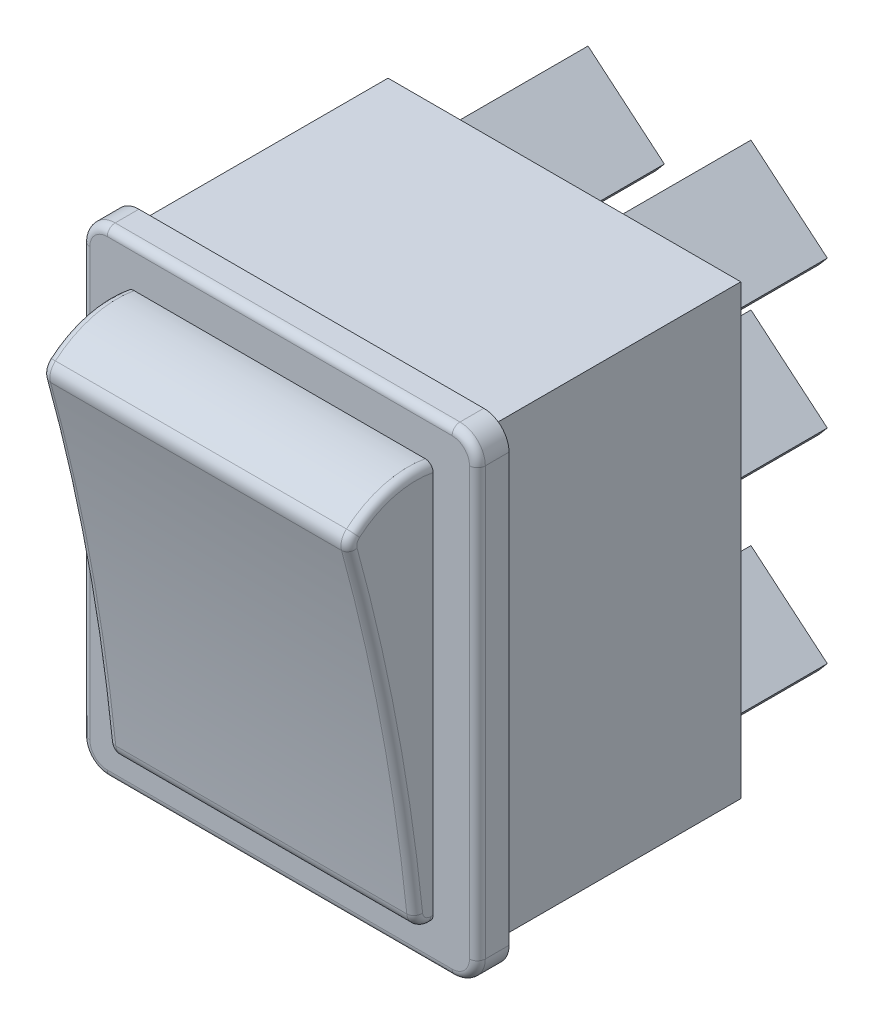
SolidWorks part; units mm, degrees
ref_plane "Front" through (0, 0, 0) normal (0, 0, 1) x (1, 0, 0)
ref_plane "Top" through (0, 0, 0) normal (0, 1, 0) x (1, 0, 0)
ref_plane "Right" through (0, 0, 0) normal (1, 0, 0) x (0, 0, -1)
sketch "Sketch1" plane through (0, 0, 0) normal (0, 0, 1) x (1, 0, 0)
  line L1 (0, 0) -> (25, 0)
  line L2 (0, 0) -> (0, 30.2)
  line L3 (0, 30.2) -> (25, 30.2)
  line L4 (25, 0) -> (25, 30.2)
  dimension "D1" = 25
  dimension "D2" = 30.2
extrude "Extrude1" add sketch "Sketch1" along normal blind 2
fillet "Fillet1" radius 1.6 4 edges at (0, 30.2, 1) (0, 0, 1) (25, 0, 1) (25, 30.2, 1)
sketch "Sketch2" plane through (0, 0, 0) normal (0, 0, -1) x (-1, 0, 0)
  line L0 (-1.35, 15.1) -> (0, 15.1) construction
  line L1 (-23.65, 29.25) -> (-1.35, 29.25)
  line L2 (-23.65, 29.25) -> (-23.65, 0.95)
  line L3 (-23.65, 0.95) -> (-1.35, 0.95)
  line L4 (-1.35, 29.25) -> (-1.35, 0.95)
  line L5 (0, 28.6) -> (0, 1.6) construction
  line L6 (-12.5, 0.95) -> (-12.5, 0) construction
  line L7 (-1.6, 0) -> (-23.4, 0) construction
  dimension "D1" = 28.3
  dimension "D2" = 22.3
extrude "Extrude2" add sketch "Sketch2" along normal blind 16
sketch "Sketch3" plane through (0, 0, -16) normal (0, 0, -1) x (-1, 0, 0)
  line L0 (-17.65, 29.25) -> (-17.65, 0.95) construction
  line L1 (-1.35, 29.25) -> (-23.65, 29.25) construction
  line L2 (-23.65, 0.95) -> (-1.35, 0.95) construction
  line L3 (-17.65, 27.7) -> (-23.15, 27.7) construction
  line L4 (-23.15, 26.2) -> (-17.65, 26.2) construction
  line L5 (-23.15, 4) -> (-17.65, 4) construction
  line L6 (-23.15, 16.9) -> (-17.65, 16.9) construction
  line L7 (-15.4941, 19.2312) -> (-20.3202, 15.1816)
  line L8 (-20.063, 24.1752) -> (-15.237, 28.2248) construction
  line L9 (-15.4941, 28.5312) -> (-14.9798, 27.9184)
  line L10 (-15.4941, 28.5312) -> (-20.3202, 24.4816)
  line L11 (-20.3202, 24.4816) -> (-19.8059, 23.8688)
  line L12 (-19.8059, 23.8688) -> (-14.9798, 27.9184)
  line L13 (-19.8059, 14.5688) -> (-14.9798, 18.6184)
  line L14 (-23.15, 27.7) -> (-23.15, 2.5) construction
  line L15 (-20.3202, 15.1816) -> (-19.8059, 14.5688)
  line L16 (-23.15, 2.5) -> (-17.65, 2.5) construction
  line L17 (-23.65, 29.25) -> (-23.65, 0.95) construction
  line L18 (-23.65, 15.1) -> (-23.15, 15.1) construction
  line L19 (-15.4941, 19.2312) -> (-14.9798, 18.6184)
  line L20 (-15.4941, 6.3312) -> (-20.3202, 2.2816)
  line L21 (-20.3202, 2.2816) -> (-19.8059, 1.6688)
  line L22 (-19.8059, 1.6688) -> (-14.9798, 5.7184)
  line L23 (-15.4941, 6.3312) -> (-14.9798, 5.7184)
  line L24 (-7.35, 29.25) -> (-7.35, 0.95) construction
  line L25 (-1.35, 29.25) -> (-23.65, 29.25) construction
  line L26 (-1.85, 29.25) -> (-1.85, 0.95) construction
  line L27 (-1.35, 0.95) -> (-1.35, 29.25) construction
  line L28 (-5.1941, 28.5312) -> (-10.0202, 24.4816)
  line L29 (-10.0202, 24.4816) -> (-9.5059, 23.8688)
  line L30 (-9.5059, 23.8688) -> (-4.6798, 27.9184)
  line L31 (-5.1941, 28.5312) -> (-4.6798, 27.9184)
  line L32 (-5.1941, 19.2312) -> (-10.0202, 15.1816)
  line L33 (-10.0202, 15.1816) -> (-9.5059, 14.5688)
  line L34 (-9.5059, 14.5688) -> (-4.6798, 18.6184)
  line L35 (-5.1941, 19.2312) -> (-4.6798, 18.6184)
  line L36 (-5.1941, 6.3312) -> (-10.0202, 2.2816)
  line L37 (-10.0202, 2.2816) -> (-9.5059, 1.6688)
  line L38 (-9.5059, 1.6688) -> (-4.6798, 5.7184)
  line L39 (-5.1941, 6.3312) -> (-4.6798, 5.7184)
  line L40 (-15.4941, 28.5312) -> (-5.1941, 28.5312) construction
  point P20 (-17.65, 26.2)
  point P23 (-15.237, 28.2248)
  dimension "D1" = 25.2
  dimension "D2" = 1.5
  dimension "D3" = 10.8
  dimension "D4" = 1.5
  dimension "D5" = 9.3
  dimension "D6" = 12.9
  dimension "D7" = 6.3
  dimension "D8" = 0.8
  dimension "D9" = 40
  dimension "D10" = 0.5
  dimension "D11" = 5.5
  dimension "D12" = 0.5
  dimension "D13" = 5.5
  dimension "D14" = 21.3
  dimension "D15" = 10.3
  dimension "D16" = 10.3
extrude "Extrude3" add sketch "Sketch3" along normal blind 8.8
sketch "Sketch4" plane through (25, 0, 0) normal (1, 0, 0) x (0, 0, -1)
  line L0 (-2, 1.6) -> (-2, 28.6) construction
  line B0 (-3.0709, 2.3484) -> (-2, 2.3484)
  line B1 (-2, 2.3484) -> (-2, 27.5891)
  arc B2 (-3.0709, 2.3484) -> (-7.4454, 25.7797) centre (-138.2287, -10.7606) ccw
  arc B3 (-7.4454, 25.7797) -> (-2, 27.5891) centre (-3.0709, 21.7133) cw
sketch_block_instance "Block1-1"
sketch_block "Block1"
extrude "Extrude4" add sketch "Sketch4" against normal offset from surface (19.4 mm away) 2.8 from offset 2.8
fillet "Fillet2" radius 1 2 edges at (12.5, 25.7797, 7.4454) (12.5, 2.3484, 3.0709)
fillet "Fillet3" radius 0.5 10 edges at (2.8, 2.3484, 2.0831) (2.8, 2.6057, 2.8359) (2.8, 27.4753, 4.6428) (2.8, 25.7654, 7.2801) (22.2, 27.4753, 4.6428) (22.2, 25.7654, 7.2801) (22.2, 2.3484, 2.0831) (22.2, 2.6057, 2.8359) (2.8, 14.3126, 4.7716) (22.2, 14.3126, 4.7716)
fillet "Fillet4" radius 0.5 8 edges at (0.4686, 0.4686, 2) (0, 15.1, 2) (0.4686, 29.7314, 2) (12.5, 30.2, 2) (24.5314, 29.7314, 2) (25, 15.1, 2) (24.5314, 0.4686, 2) (12.5, 0, 2)
